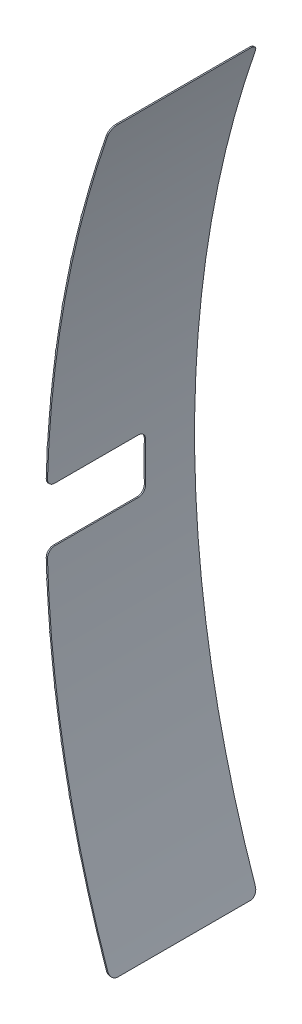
SolidWorks part; units mm, degrees
ref_plane "前视基准面" through (0, 0, 0) normal (0, 0, 1) x (1, 0, 0)
ref_plane "上视基准面" through (0, 0, 0) normal (0, 1, 0) x (1, 0, 0)
ref_plane "右视基准面" through (0, 0, 0) normal (1, 0, 0) x (0, 0, -1)
sketch "草图1" plane through (0, 0, 0) normal (0, 0, 1) x (1, 0, 0)
  line L0 (-42.4794, 15) -> (-42.4264, 15)
  line L1 (-42.4794, -15) -> (-42.4264, -15)
  line L2 (-1000, 0) -> (49000, 0) construction
  arc A0 (-42.4794, 15) -> (-42.4794, -15) centre (0, 0) ccw
  arc A1 (-42.4264, 15) -> (-42.4264, -15) centre (0, 0) ccw
  dimension "D1" = 90.1
  dimension "D2" = 90
  dimension "D3" = 30
extrude "凸台-拉伸1" add sketch "草图1" along normal blind 6
ref_plane "基准面1" through (-50, 0, 0) normal (1, 0, 0) x (0, 0, -1)
sketch "草图4" plane through (0, 0, 0) normal (1, 0, 0) x (0, 0, -1)
  line L0 (-6, -1.1) -> (-2, -1.1)
  line L1 (-6, 15) -> (-6, -15) construction
  line L2 (-2, -1.1) -> (-2, 1.1)
  line L3 (-2, 1.1) -> (-6, 1.1)
  line L4 (-6, 1.1) -> (-6, -1.1)
  line L5 (-1000, 0) -> (49000, 0) construction
  dimension "D1" = 4
  dimension "D2" = 2.2
extrude "切除-拉伸1" cut sketch "草图4" against normal through all
fillet "圆角1" radius 0.3 8 edges at (-42.4529, -15, 6) (-42.4529, -15, 0) (-42.4529, 15, 6) (-42.4529, 15, 0) (-45.0116, -1.1, 2) (-45.0116, 1.1, 2) (-45.0116, 1.1, 6) (-45.0116, -1.1, 6)
sketch "草图5" plane through (-50, 0, 0) normal (1, 0, 0) x (0, 0, -1)
  line L0 (0, -2.8572) -> (0, 3.1428)
  line L1 (0, 3.1428) -> (-2, 0.1428)
  line L2 (-2, 0.1428) -> (0, -2.8572)
  line L3 (-1002, 0.1428) -> (48998, 0.1428) construction
  line L4 (0, -14.7) -> (0, 14.7) construction
  line L5 (-2, 0.8) -> (-2, -0.8) construction
  line L6 (-6, -1.4) -> (-6, -14.7) construction
  line L7 (-6, -2.3) -> (-2, -2.3)
  line L8 (-6, -2.3) -> (-6, -2.1)
  line L9 (-6, -2.1) -> (-2, -2.1)
  line L10 (-2, -2.3) -> (-2, -2.1)
  line L31 (-5.7, -1.1) -> (-2.3, -1.1) construction
  line L56 (-6, -4.1) -> (-2, -4.1)
  line L57 (-6, -4.1) -> (-6, -3.9)
  line L58 (-6, -3.9) -> (-2, -3.9)
  line L59 (-2, -4.1) -> (-2, -3.9)
  line L60 (-6, -5.9) -> (-2, -5.9)
  line L61 (-6, -5.9) -> (-6, -5.7)
  line L62 (-6, -5.7) -> (-2, -5.7)
  line L63 (-2, -5.9) -> (-2, -5.7)
  line L64 (-6, -7.7) -> (-2, -7.7)
  line L65 (-6, -7.7) -> (-6, -7.5)
  line L66 (-6, -7.5) -> (-2, -7.5)
  line L67 (-2, -7.7) -> (-2, -7.5)
  line L68 (-6, -9.5) -> (-2, -9.5)
  line L69 (-6, -9.5) -> (-6, -9.3)
  line L70 (-6, -9.3) -> (-2, -9.3)
  line L71 (-2, -9.5) -> (-2, -9.3)
  line L72 (-6, -11.3) -> (-2, -11.3)
  line L73 (-6, -11.3) -> (-6, -11.1)
  line L74 (-6, -11.1) -> (-2, -11.1)
  line L75 (-2, -11.3) -> (-2, -11.1)
  line L76 (-6, -2.3) -> (-6, -4.1) construction
  line L77 (-6, 2.5855) -> (-6, 4.3855) construction
  line L78 (-2, 11.5855) -> (-2, 11.3855)
  line L79 (-6, 11.3855) -> (-2, 11.3855)
  line L80 (-6, 11.5855) -> (-6, 11.3855)
  line L81 (-6, 11.5855) -> (-2, 11.5855)
  line L82 (-2, 9.7855) -> (-2, 9.5855)
  line L83 (-6, 9.5855) -> (-2, 9.5855)
  line L84 (-6, 9.7855) -> (-6, 9.5855)
  line L85 (-6, 9.7855) -> (-2, 9.7855)
  line L86 (-2, 7.9855) -> (-2, 7.7855)
  line L87 (-6, 7.7855) -> (-2, 7.7855)
  line L88 (-6, 7.9855) -> (-6, 7.7855)
  line L89 (-6, 7.9855) -> (-2, 7.9855)
  line L90 (-2, 6.1855) -> (-2, 5.9855)
  line L91 (-6, 5.9855) -> (-2, 5.9855)
  line L92 (-6, 6.1855) -> (-6, 5.9855)
  line L93 (-6, 6.1855) -> (-2, 6.1855)
  line L94 (-2, 4.3855) -> (-2, 4.1855)
  line L95 (-6, 4.1855) -> (-2, 4.1855)
  line L96 (-6, 4.3855) -> (-6, 4.1855)
  line L97 (-6, 4.3855) -> (-2, 4.3855)
  line L98 (-2, 2.5855) -> (-2, 2.3855)
  line L99 (-6, 2.3855) -> (-2, 2.3855)
  line L100 (-6, 2.5855) -> (-6, 2.3855)
  line L101 (-6, 2.5855) -> (-2, 2.5855)
  line L116 (-5.7, 15) -> (-0.3, 15) construction
  line L117 (-4.8, 13.5) -> (-3.65, 13.5)
  line L118 (-4.8, 13.5) -> (-4.8, 13.3)
  line L119 (-4.8, 13.3) -> (-3.65, 13.3)
  line L120 (-2.3, 13.5) -> (-2.3, 13.3)
  line L121 (-6, 14.7) -> (-6, 1.4) construction
  line L122 (-3.65, 14.65) -> (-3.45, 14.65)
  line L123 (-3.65, 14.65) -> (-3.65, 13.5)
  line L124 (-3.65, 12.15) -> (-3.45, 12.15)
  line L125 (-3.45, 14.65) -> (-3.45, 13.5)
  line L126 (-5.7, -15) -> (-0.3, -15) construction
  line L127 (-3.65, -12.15) -> (-3.45, -12.15)
  line L128 (-3.65, -12.15) -> (-3.65, -14.65)
  line L129 (-3.65, -14.65) -> (-3.45, -14.65)
  line L130 (-3.45, -12.15) -> (-3.45, -14.65)
  line L131 (-3.45, 13.3) -> (-3.45, 12.15)
  line L132 (-3.45, 13.5) -> (-2.3, 13.5)
  line L133 (-3.65, 13.3) -> (-3.65, 12.15)
  line L134 (-3.45, 13.3) -> (-2.3, 13.3)
  point P81 (-3.65, -13.4)
  dimension "D1" = 6
  dimension "D2" = 0.2
  dimension "D3" = 6
  dimension "D5" = 1
  dimension "D4" = 1.8
  dimension "D6" = 2.5
  dimension "D7" = 0.2
  dimension "D8" = 1.5
  dimension "D9" = 2.5
  dimension "D10" = 0.2
  dimension "D11" = 1.15
  dimension "D12" = 1.15
  dimension "D13" = 1.2
  dimension "D14" = 2.5
  dimension "D15" = 0.2
  dimension "D16" = 0.35
  dimension "D17" = 2.35
wrap "包覆1" sketch "草图5" wrap type emboss source sketch "草图5" thickness 0.01 parameters "D1"=0.01
